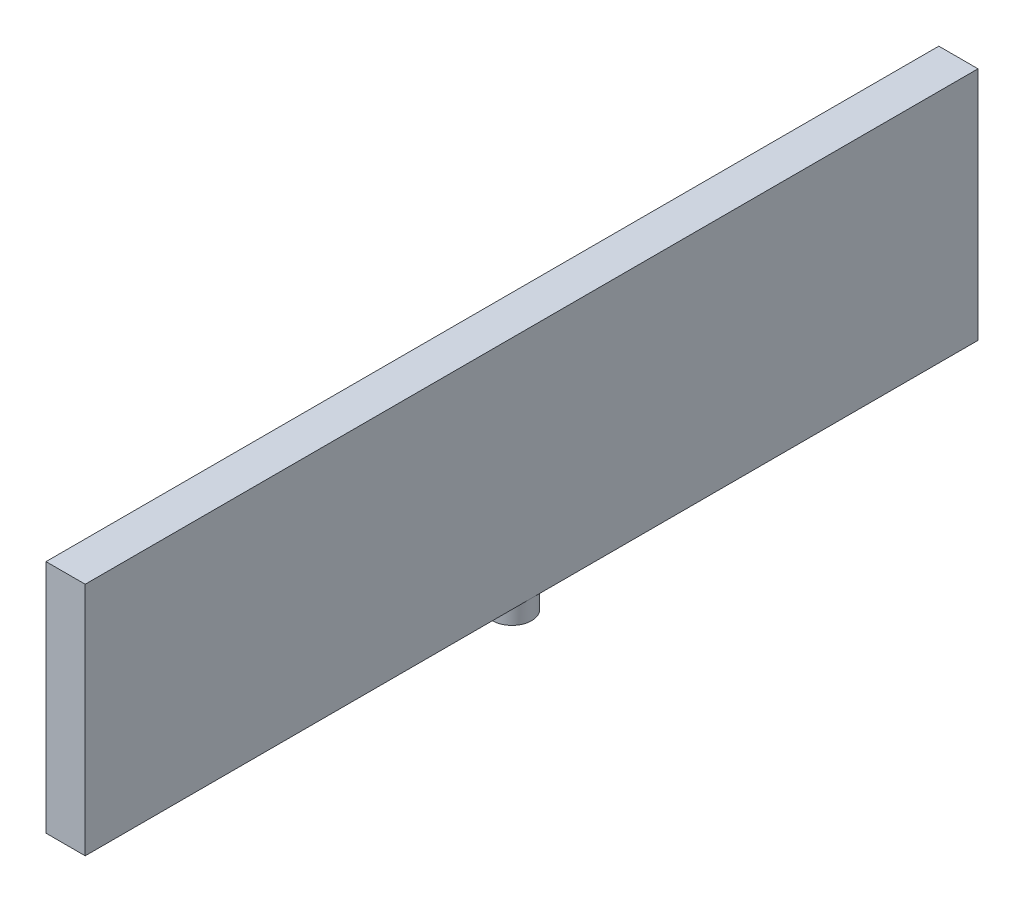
SolidWorks part; units mm, degrees
ref_plane "Front Plane" through (0, 0, 0) normal (0, 0, 1) x (1, 0, 0)
ref_plane "Top Plane" through (0, 0, 0) normal (0, 1, 0) x (1, 0, 0)
ref_plane "Right Plane" through (0, 0, 0) normal (1, 0, 0) x (0, 0, -1)
sketch "Sketch1" plane through (0, 0, 0) normal (0, 0, 1) x (1, 0, 0)
  line L1 (260.1559, 291.7203) -> (272.8559, 291.7203)
  line L2 (260.1559, 291.7203) -> (260.1559, 367.9203)
  line L3 (260.1559, 367.9203) -> (272.8559, 367.9203)
  line L4 (272.8559, 291.7203) -> (272.8559, 367.9203)
  line L8 (260.1559, 291.7203) -> (-527.2441, 291.7203) construction
  line L9 (-527.2441, 367.9203) -> (260.1559, 367.9203) construction
  dimension "D2" = 12.7
extrude "Extrude1" add sketch "Sketch1" against normal up to surface (289.2216 mm away)
sketch "Sketch2" plane through (0, 291.7203, 0) normal (0, -1, 0) x (1, 0, 0)
  line L0 (266.5059, 0) -> (266.5059, -289.2216) construction
  line L1 (260.1559, 0) -> (272.8559, 0) construction
  line L2 (272.8559, -289.2216) -> (260.1559, -289.2216) construction
  circle A0 centre (266.5059, -144.6108) radius 6.35
  dimension "D1" = 12.7
extrude "Extrude2" add sketch "Sketch2" along normal blind 6.35
